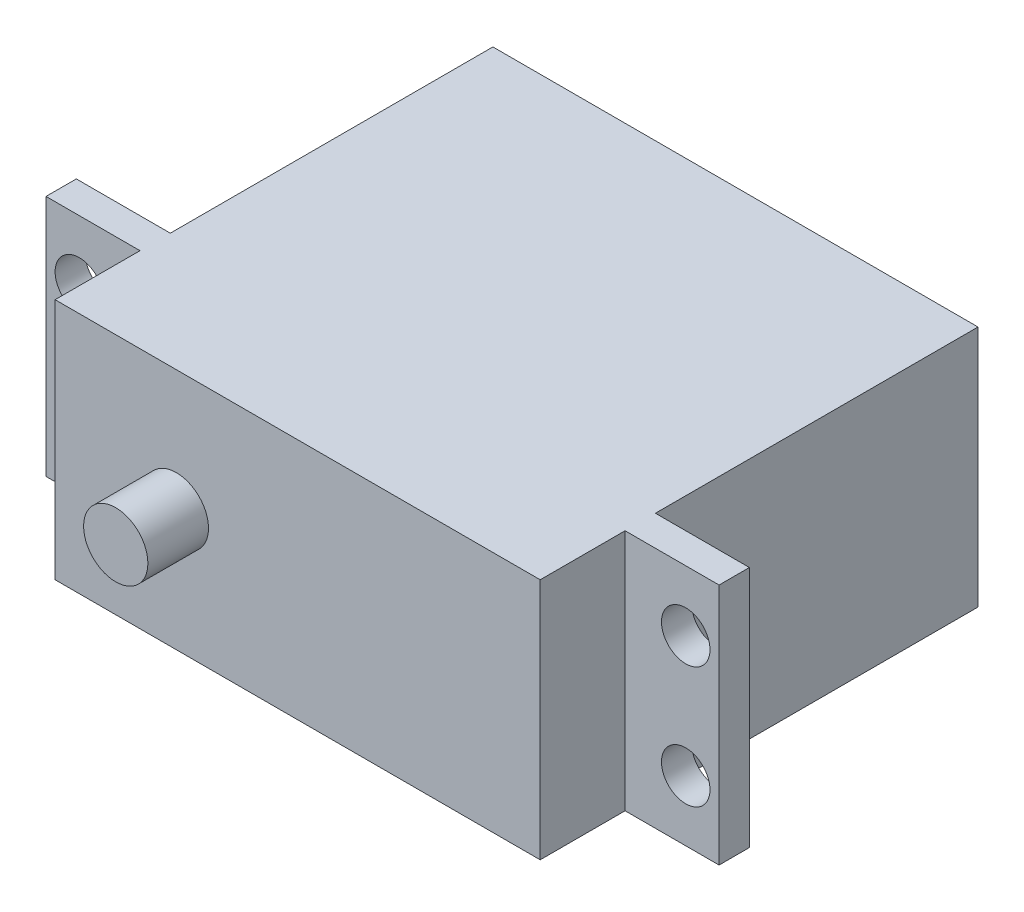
SolidWorks part; units mm, degrees
ref_plane "Plan de face" through (0, 0, 0) normal (0, 0, 1) x (1, 0, 0)
ref_plane "Plan de dessus" through (0, 0, 0) normal (0, 1, 0) x (1, 0, 0)
ref_plane "Plan de droite" through (0, 0, 0) normal (1, 0, 0) x (0, 0, -1)
sketch "Esquisse1" plane through (0, 0, 0) normal (0, 0, 1) x (1, 0, 0)
  line L1 (0, 0) -> (40, 0)
  line L2 (0, 0) -> (0, 20)
  line L3 (0, 20) -> (40, 20)
  line L4 (40, 0) -> (40, 20)
  dimension "D1" = 20
  dimension "D2" = 40
extrude "Boss.-Extru.1" add sketch "Esquisse1" along normal blind 36.1
sketch "Esquisse2" plane through (40, 0, 0) normal (1, 0, 0) x (0, 0, -1)
  line L0 (-36.1, 20) -> (0, 20) construction
  line L1 (-29.1, 20) -> (-26.6, 20)
  line L2 (-29.1, 20) -> (-29.1, 0)
  line L3 (-29.1, 0) -> (-26.6, 0)
  line L4 (-26.6, 20) -> (-26.6, 0)
  line L5 (-36.1, 0) -> (0, 0) construction
  line L6 (0, 0) -> (0, 20) construction
  dimension "D1" = 2.5
  dimension "D2" = 26.6
extrude "Boss.-Extru.2" add sketch "Esquisse2" along normal blind 7.75 and the other way blind 47.75
sketch "Esquisse3" plane through (0, 0, 29.1) normal (0, 0, 1) x (1, 0, 0)
  line L0 (47.75, 10) -> (-7.75, 10) construction
  line L1 (47.75, 20) -> (47.75, 0) construction
  line L2 (-7.75, 20) -> (-7.75, 0) construction
  line L3 (45, 15) -> (45, 5) construction
  line L4 (40, 0) -> (40, 20) construction
  circle A0 centre (45, 15) radius 2
  circle A1 centre (45, 5) radius 2
  dimension "D1" = 5
  dimension "D2" = 5
  dimension "D3" = 5
extrude "Enlèv. mat.-Extru.1" cut sketch "Esquisse3" against normal blind 7.5
sketch "Esquisse4" plane through (0, 0, 29.1) normal (0, 0, 1) x (1, 0, 0)
  line L0 (-7.75, 10) -> (0, 10) construction
  line L1 (-7.75, 20) -> (-7.75, 0) construction
  line L2 (0, 20) -> (0, 0) construction
  line L3 (-5, 15) -> (-5, 5) construction
  circle A0 centre (-5, 15) radius 2
  circle A1 centre (-5, 5) radius 2
  dimension "D1" = 5
  dimension "D2" = 5
  dimension "D3" = 5
extrude "Enlèv. mat.-Extru.2" cut sketch "Esquisse4" against normal blind 7.5
sketch "Esquisse5" plane through (0, 0, 36.1) normal (0, 0, 1) x (1, 0, 0)
  line L0 (0, 10) -> (40, 10) construction
  line L1 (0, 20) -> (0, 0) construction
  line L2 (40, 0) -> (40, 20) construction
  line L3 (10, 14.4833) -> (10, 3.5591) construction
  circle A0 centre (10, 10) radius 2.65
  dimension "D2" = 5.3
  dimension "D1" = 10
extrude "Boss.-Extru.3" add sketch "Esquisse5" along normal blind 5
